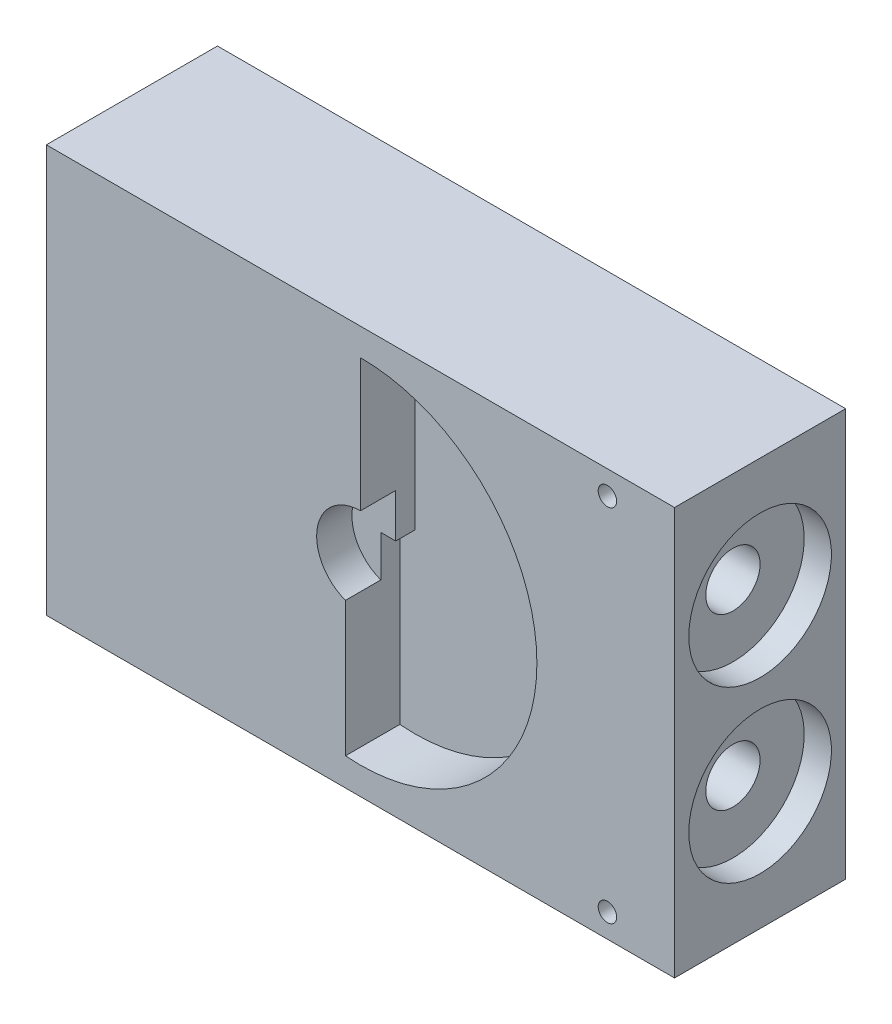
SolidWorks part; units mm, degrees
ref_plane "Front" through (0, 0, 0) normal (0, 0, 1) x (1, 0, 0)
ref_plane "Top" through (0, 0, 0) normal (0, 1, 0) x (1, 0, 0)
ref_plane "Right" through (0, 0, 0) normal (1, 0, 0) x (0, 0, -1)
imported_body "Imported1"
sketch "Sketch1" plane through (0, 0, 16.002) normal (0, 0, 1) x (1, 0, 0)
  line L0 (-2.794, 0) -> (33.0004, 0)
  line L1 (-2.794, 0) -> (-2.794, -32.8819)
  arc A0 (-2.794, -32.8819) -> (33.0004, 0) centre (0, 0) ccw
  circle A1 centre (0, 0) radius 8.1915 construction
  dimension "D1" = 2.794
extrude "Cut-Extrude1" cut sketch "Sketch1" against normal blind 10.16
sketch "Sketch2" plane through (0, 0, 16.002) normal (0, 0, 1) x (1, 0, 0)
  line L0 (0, 0) -> (0, 33.0004)
  line L1 (0, 0) -> (33.0004, 0)
  arc A0 (33.0004, 0) -> (0, 33.0004) centre (0, 0) ccw
  arc A1 (-2.794, -32.8819) -> (33.0004, 0) centre (0, 0) ccw construction
extrude "Cut-Extrude2" cut sketch "Sketch2" against normal blind 10.16
hole_wizard "#8-32 Tapped Hole1" positions "Sketch3" profile "Sketch4" tap size "#8-32" standard "ANSI Inch"
sketch "Sketch3" plane through (0, 0, 16.002) normal (0, 0, 1) x (1, 0, 0)
  line L0 (58.7375, -38.1) -> (58.7375, 38.1) construction
  line L1 (-58.7375, -38.1) -> (58.7375, -38.1) construction
  line L2 (58.7375, 38.1) -> (-58.7375, 38.1) construction
  point P0 (46.1899, 33.6804)
  point P2 (46.1899, -33.6804)
  dimension "D1" = 12.5476
  dimension "D2" = 12.5476
  dimension "D3" = 4.4196
  dimension "D4" = 4.4196
sketch "Sketch4" plane through (46.1899, 33.6804, 16.002) normal (1, 0, 0) x (0, -1, 0)
  line L0 (0, 0) -> (0, 13.3314)
  line L1 (0, 13.3314) -> (1.7272, 12.2936)
  line L2 (1.7272, 12.2936) -> (1.7272, 0)
  line L5 (1.7272, 0) -> (0, 0)
  line L10 (0, 13.3314) -> (-1.7272, 12.2936) construction
  line L11 (0, -6.35) -> (0, 107.95) construction
  dimension "Tap Drill Dia." = 3.4544
  dimension "Tap Drill Depth" = 12.2936
  dimension "Drill Angle" = 118
